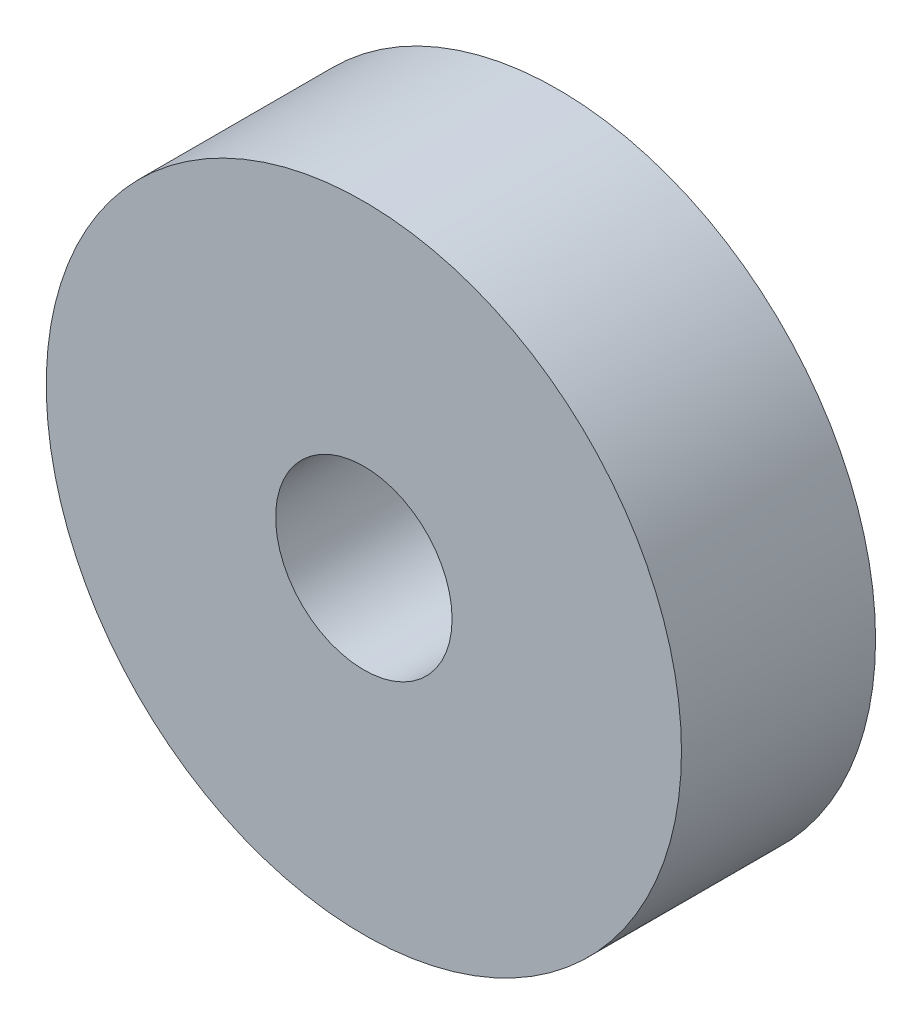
SolidWorks part; units mm, degrees
ref_plane "Front Plane" through (0, 0, 0) normal (0, 0, 1) x (1, 0, 0)
ref_plane "Top Plane" through (0, 0, 0) normal (0, 1, 0) x (1, 0, 0)
ref_plane "Right Plane" through (0, 0, 0) normal (1, 0, 0) x (0, 0, -1)
sketch "Sketch1" plane through (0, 0, 0) normal (0, 0, 1) x (1, 0, 0)
  circle A0 centre (0, 0) radius 2.5
  circle A1 centre (0, 0) radius 9
extrude "Boss-Extrude1" add sketch "Sketch1" along normal blind 5.5
